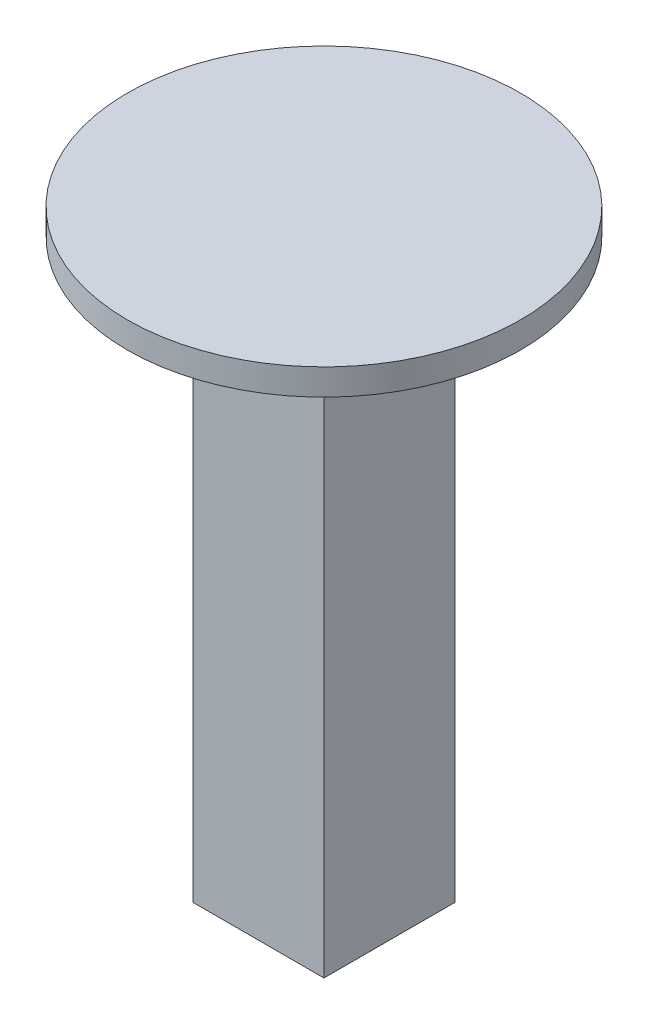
SolidWorks part; units mm, degrees
ref_plane "Front Plane" through (0, 0, 0) normal (0, 0, 1) x (1, 0, 0)
ref_plane "Top Plane" through (0, 0, 0) normal (0, 1, 0) x (1, 0, 0)
ref_plane "Right Plane" through (0, 0, 0) normal (1, 0, 0) x (0, 0, -1)
sketch "Sketch1" plane through (0, 0, 0) normal (0, 1, 0) x (1, 0, 0)
  line L1 (-25, 25) -> (25, 25)
  line L2 (-25, 25) -> (-25, -25)
  line L3 (-25, -25) -> (25, -25)
  line L4 (25, 25) -> (25, -25)
  line L5 (-25, 25) -> (25, -25) construction
  line L6 (-25, -25) -> (25, 25) construction
  point P0 (0, 0)
  dimension "D1" = 50
  dimension "D2" = 50
extrude "Boss-Extrude1" add sketch "Sketch1" along normal blind 50 contours L1 L4 L3 L2
sketch "Sketch2" plane through (0, 0, 25) normal (0, 0, 1) x (1, 0, 0)
  line L1 (25, 50) -> (-25, 50)
  line L2 (25, 50) -> (25, 180)
  line L3 (25, 180) -> (-25, 180)
  line L4 (-25, 50) -> (-25, 180)
  dimension "D1" = 130
sketch "Sketch3" plane through (25, 0, 0) normal (1, 0, 0) x (0, 0, -1)
  line L0 (-25, 50) -> (-25, 180) construction
  line L1 (-25, 180) -> (25, 180)
  line L2 (-25, 180) -> (-25, 50)
  line L3 (-25, 50) -> (25, 50)
  line L4 (25, 180) -> (25, 50)
sketch "Sketch4" plane through (0, 0, -25) normal (0, 0, -1) x (-1, 0, 0)
  line L1 (-25, 180) -> (25, 180)
  line L2 (-25, 180) -> (-25, 50)
  line L3 (-25, 50) -> (25, 50)
  line L4 (25, 180) -> (25, 50)
sketch "Sketch5" plane through (-25, 0, 0) normal (-1, 0, 0) x (0, 0, 1)
  line L1 (-25, 180) -> (25, 180)
  line L2 (-25, 180) -> (-25, 50)
  line L3 (-25, 50) -> (25, 50)
  line L4 (25, 180) -> (25, 50)
extrude "Boss-Extrude2" add sketch "Sketch4" against normal blind 5 contours L4 L3 L2 L1
extrude "Boss-Extrude3" add sketch "Sketch3" against normal blind 5 contours L1 L4 L3 L2
extrude "Boss-Extrude4" add sketch "Sketch2" against normal blind 5 contours L3 L4 L1 L2
extrude "Boss-Extrude5" add sketch "Sketch5" against normal blind 5 contours L1 L4 L3 L2
sketch "Sketch6" plane through (0, 180, 0) normal (0, 1, 0) x (1, 0, 0)
  line L1 (-25, 25) -> (25, 25)
  line L2 (-25, 25) -> (-25, -25)
  line L3 (-25, -25) -> (25, -25)
  line L4 (25, 25) -> (25, -25)
extrude "Boss-Extrude6" add sketch "Sketch6" along normal blind 50
sketch "Sketch10" plane through (0, 230, 0) normal (0, 1, 0) x (1, 0, 0)
  circle A0 centre (0, 0) radius 75
extrude "Boss-Extrude7" add sketch "Sketch10" against normal blind 10 contours A0
sketch "Sketch11" plane through (0, 0, 0) normal (0, -1, 0) x (1, 0, 0)
  circle A0 centre (0, 0) radius 4
extrude "Cut-Extrude1" cut sketch "Sketch11" against normal blind 22
